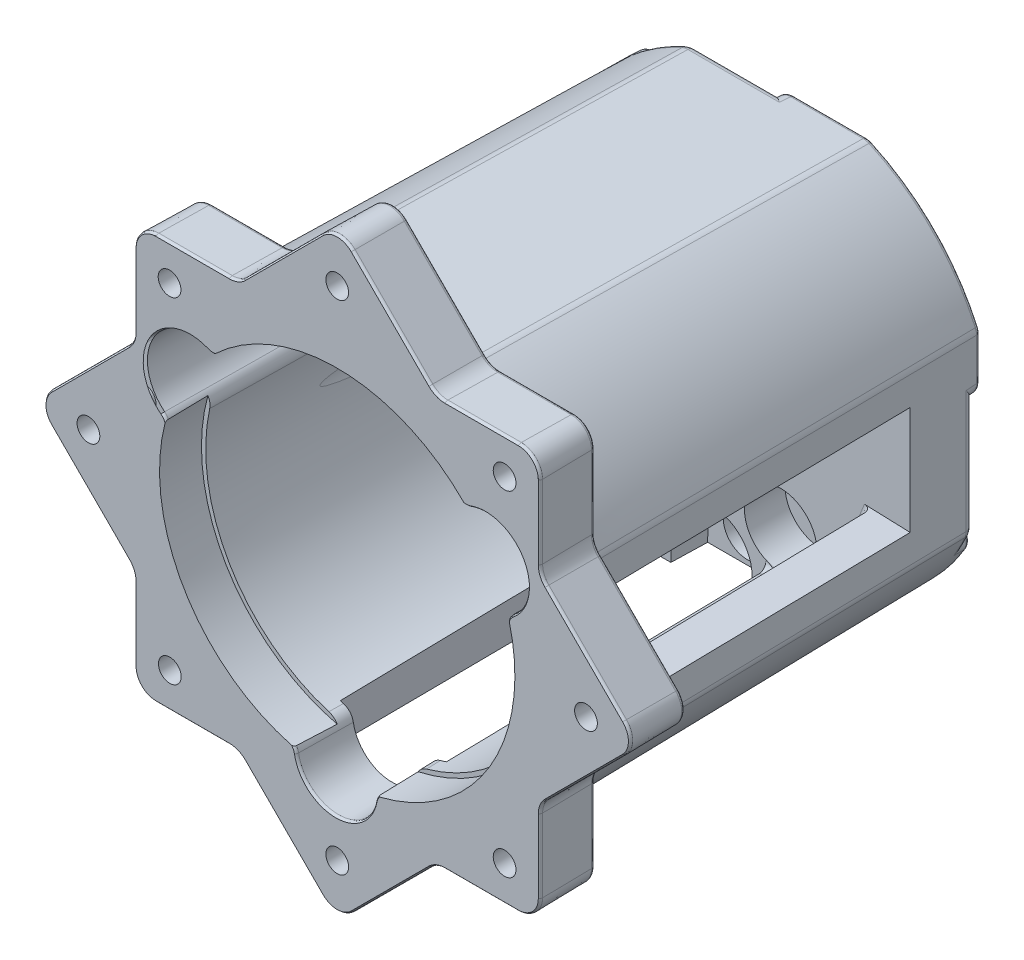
SolidWorks part; units mm, degrees
ref_plane "前视基准面" through (0, 0, 0) normal (0, 0, 1) x (1, 0, 0)
ref_plane "上视基准面" through (0, 0, 0) normal (0, 1, 0) x (1, 0, 0)
ref_plane "右视基准面" through (0, 0, 0) normal (1, 0, 0) x (0, 0, -1)
imported_body "输入1"
sketch "草图1" plane through (0, 0, 60) normal (0, 0, 1) x (1, 0, 0)
  circle A0 centre (0, 0) radius 25
  dimension "D1" = 50
extrude "切除-拉伸1" cut sketch "草图1" against normal blind 6
sketch "草图2" plane through (0, 0, 60) normal (0, 0, 1) x (1, 0, 0)
  line L1 (-56.8509, 50.3947) -> (60.1398, 50.3947)
  line L2 (-56.8509, 50.3947) -> (-56.8509, -49.4468)
  line L3 (-56.8509, -49.4468) -> (60.1398, -49.4468)
  line L4 (60.1398, 50.3947) -> (60.1398, -49.4468)
extrude "切除-拉伸2" cut sketch "草图2" against normal blind 0.1
sketch "草图3" plane through (0, 0, -3) normal (0, 0, -1) x (-1, 0, 0)
  line L1 (86.4504, 60.2611) -> (-77.2885, 60.2611)
  line L2 (86.4504, 60.2611) -> (86.4504, -65.186)
  line L3 (86.4504, -65.186) -> (-77.2885, -65.186)
  line L4 (-77.2885, 60.2611) -> (-77.2885, -65.186)
extrude "切除-拉伸3" cut sketch "草图3" against normal blind 0.1
